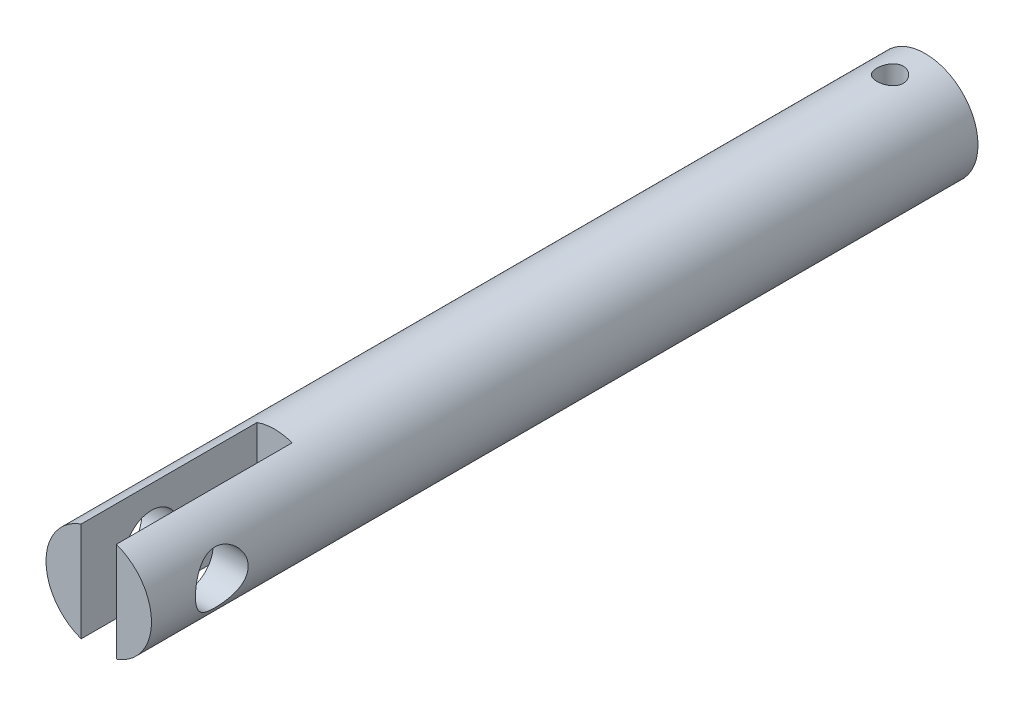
SolidWorks part; units mm, degrees
ref_plane "Front Plane" through (0, 0, 0) normal (0, 0, 1) x (1, 0, 0)
ref_plane "Top Plane" through (0, 0, 0) normal (0, 1, 0) x (1, 0, 0)
ref_plane "Right Plane" through (0, 0, 0) normal (1, 0, 0) x (0, 0, -1)
sketch "Sketch1" plane through (0, 0, 0) normal (0, 0, 1) x (1, 0, 0)
  circle A0 centre (0, 0) radius 4.7625
  dimension "D1" = 9.525
extrude "Extrude1" add sketch "Sketch1" along normal blind 74.6125
sketch "Sketch2" plane through (0, 0, 0) normal (0, 1, 0) x (1, 0, 0)
  line L0 (0, 0) -> (0, -58.7375) construction
  line L1 (-1.5875, -74.6125) -> (1.5875, -74.6125)
  line L2 (-1.5875, -74.6125) -> (-1.5875, -58.7375)
  line L3 (-1.5875, -58.7375) -> (1.5875, -58.7375)
  line L4 (1.5875, -74.6125) -> (1.5875, -58.7375)
  line L5 (-4.7625, -74.6125) -> (4.7625, -74.6125) construction
  circle A0 centre (0, -3.175) radius 1.1906
  dimension "D1" = 2.3813
  dimension "D2" = 3.175
  dimension "D3" = 3.175
  dimension "D4" = 15.875
extrude "Cut-Extrude1" cut sketch "Sketch2" against normal through all and the other way through all
sketch "Sketch3" plane through (0, 0, 0) normal (1, 0, 0) x (0, 0, -1)
  line L0 (-74.6125, 4.4901) -> (-74.6125, -4.4901) construction
  circle A0 centre (-68.2625, 0) radius 2.3813
  point P2 (-74.6125, 0)
  dimension "D2" = 4.7625
  dimension "D1" = 6.35
extrude "Cut-Extrude2" cut sketch "Sketch3" against normal through all and the other way through all
